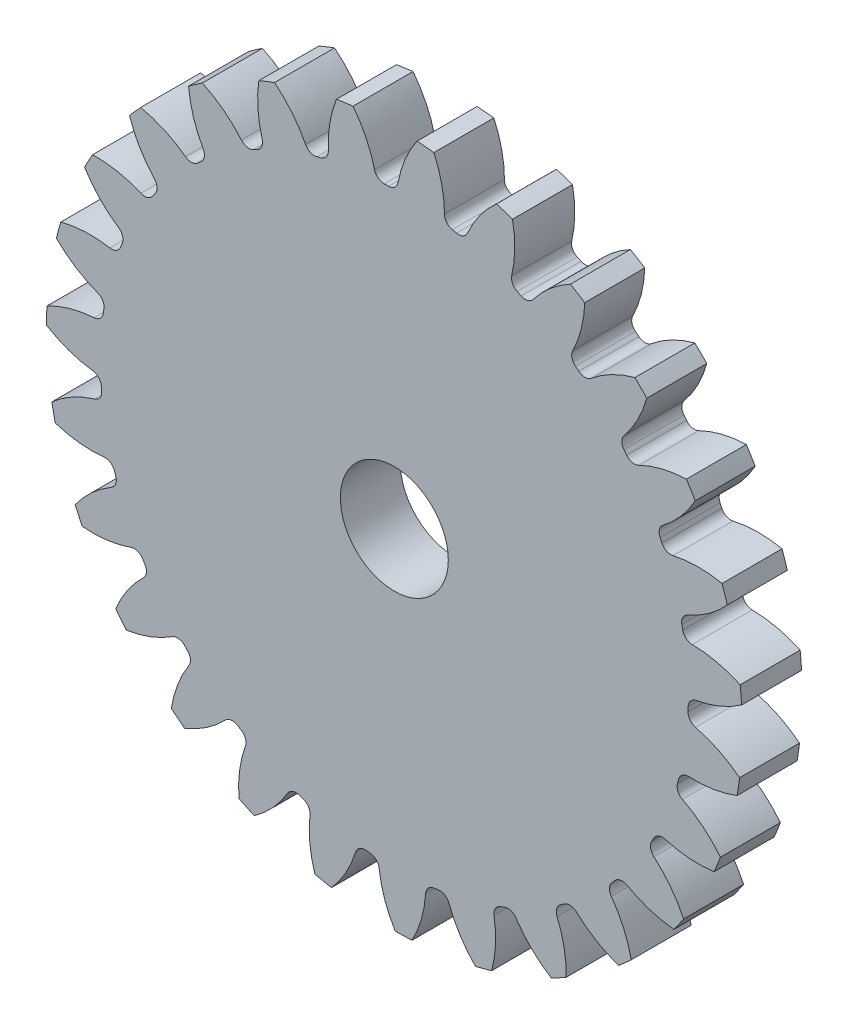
SolidWorks part; units mm, degrees
ref_plane "Front" through (0, 0, 0) normal (0, 0, 1) x (1, 0, 0)
ref_plane "Top" through (0, 0, 0) normal (0, 1, 0) x (1, 0, 0)
ref_plane "Right" through (0, 0, 0) normal (1, 0, 0) x (0, 0, -1)
sketch "Sketch3" plane through (0, 0, 0) normal (0, 0, 1) x (1, 0, 0)
  circle A0 centre (0, 0) radius 736.6
  dimension "od" = 1473.2
extrude "gearBody" add sketch "Sketch3" along normal blind 127
sketch "Sketch2" plane through (0, 0, 0) normal (0, 0, 1) x (1, 0, 0)
  line L0 (0, 0) -> (595.386, 246.617) construction
  line L1 (732.275, -91.8282) -> (0, 0) construction
  line L2 (0, 0) -> (36.3143, 0) construction
  line L3 (685.5609, 18.1065) -> (683.0658, -61.1782) construction
  line L5 (684.3134, -21.5358) -> (0, 0) construction
  line L7 (0, 0) -> (644.4412, 0) construction
  arc A0 (644.4142, 5.8998) -> (642.768, -46.4083) centre (0, 0) ccw construction
  arc A1 (735.2451, 44.6566) -> (730.9822, -90.7998) centre (0, 0) ccw construction
  arc A2 (685.5609, 18.1065) -> (683.0658, -61.1782) centre (0, 0) ccw construction
  arc A3 (621.8301, -24.1798) -> (622.12, -14.9682) centre (0, 0) ccw
  arc A4 (732.275, -91.8282) -> (637.5381, -45.057) centre (578.7008, -283.5663) ccw
  arc A5 (732.275, -91.8282) -> (736.6, 45.6017) centre (0, 0) ccw
  arc A6 (736.6, 45.6017) -> (639.1096, 4.88) centre (595.386, 246.617) cw
  arc A7 (622.12, -14.9682) -> (639.1096, 4.88) centre (642.7896, -15.4655) cw
  arc A8 (637.5381, -45.057) -> (621.8301, -24.1798) centre (642.4901, -24.9831) cw
  point P6 (736.6, 45.6017)
  point P22 (732.275, -91.8282)
  dimension "baseDia" = 1288.8824
  dimension "od" = 1473.2
  dimension "pd" = 1371.6
  dimension "rd" = 1244.6
  dimension "rFillet" = 20.6756
  dimension "pointX" = 736.6
  dimension "pointY" = 45.6017
  dimension "CTT" = 79.2847
  dimension "flankCenterAngle" = 22.5
extrude "toothCut" cut sketch "Sketch2" along normal through all
pattern_circular "CirPattern1" count 27 over 360 about axis through (0, 0, 0) along (0, 0, 1) of "toothCut"
sketch "hub1Dia" plane through (0, 0, 0) normal (0, 0, -1) x (-1, 0, 0)
  circle A0 centre (0, 0) radius 12.7
  dimension "hub1Dia" = 25.4
sketch "hub2Dia" plane through (0, 0, 127) normal (0, 0, 1) x (1, 0, 0)
  circle A0 centre (0, 0) radius 12.7
  dimension "hub2dia" = 25.4
sketch "boreDia" plane through (0, 0, 0) normal (0, 0, 1) x (1, 0, 0)
  circle A0 centre (0, 0) radius 114.3
  dimension "boreDia" = 228.6
extrude "bore" cut sketch "boreDia" against normal mid plane 25400
